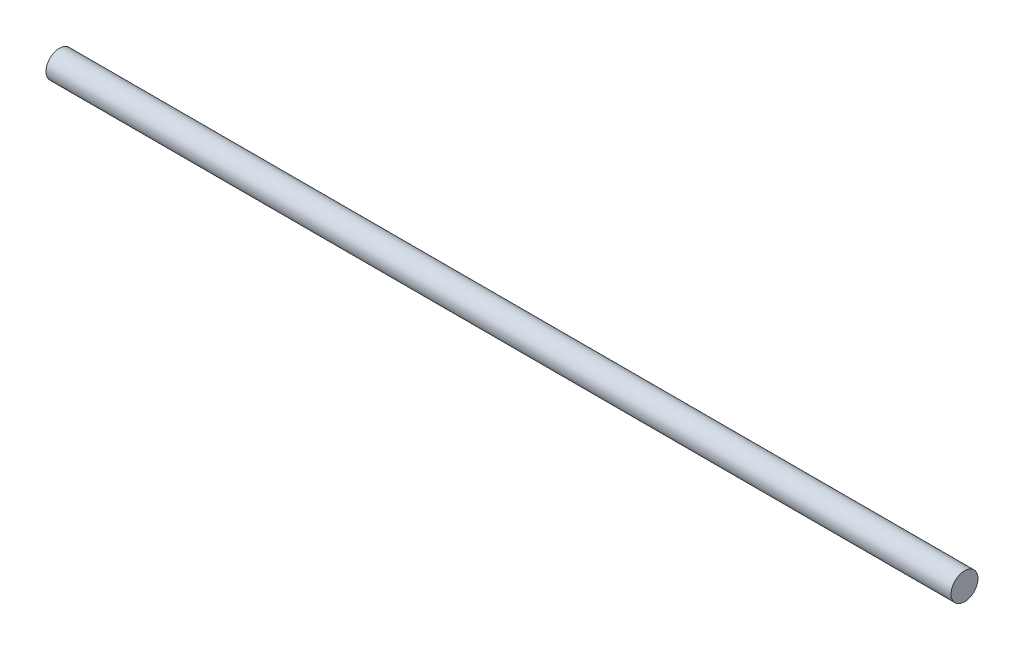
SolidWorks part; units mm, degrees
ref_plane "Alzado" through (0, 0, 0) normal (0, 0, 1) x (1, 0, 0)
ref_plane "Planta" through (0, 0, 0) normal (0, 1, 0) x (1, 0, 0)
ref_plane "Vista lateral" through (0, 0, 0) normal (1, 0, 0) x (0, 0, -1)
sketch "Croquis1" plane through (0, 0, 0) normal (1, 0, 0) x (0, 0, -1)
  circle A0 centre (0, 0) radius 5.95
  dimension "D1" = 11.9
extrude "Saliente-Extruir1" add sketch "Croquis1" along normal blind 400
